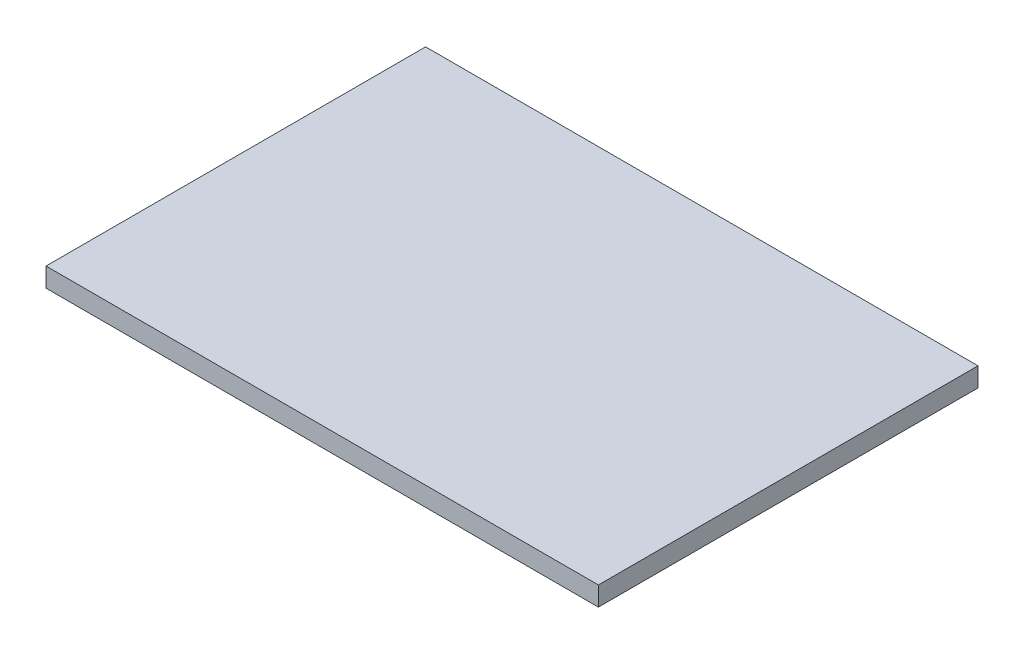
SolidWorks part; units mm, degrees
ref_plane "Front Plane" through (0, 0, 0) normal (0, 0, 1) x (1, 0, 0)
ref_plane "Top Plane" through (0, 0, 0) normal (0, 1, 0) x (1, 0, 0)
ref_plane "Right Plane" through (0, 0, 0) normal (1, 0, 0) x (0, 0, -1)
sketch "Sketch1" plane through (0, 0, 0) normal (0, 1, 0) x (1, 0, 0)
  line L1 (0, 0) -> (57.51, 0)
  line L2 (0, 0) -> (0, 39.52)
  line L3 (0, 39.52) -> (57.51, 39.52)
  line L4 (57.51, 0) -> (57.51, 39.52)
  dimension "D1" = 39.52
  dimension "D2" = 57.51
extrude "Boss-Extrude1" add sketch "Sketch1" along normal blind 2
